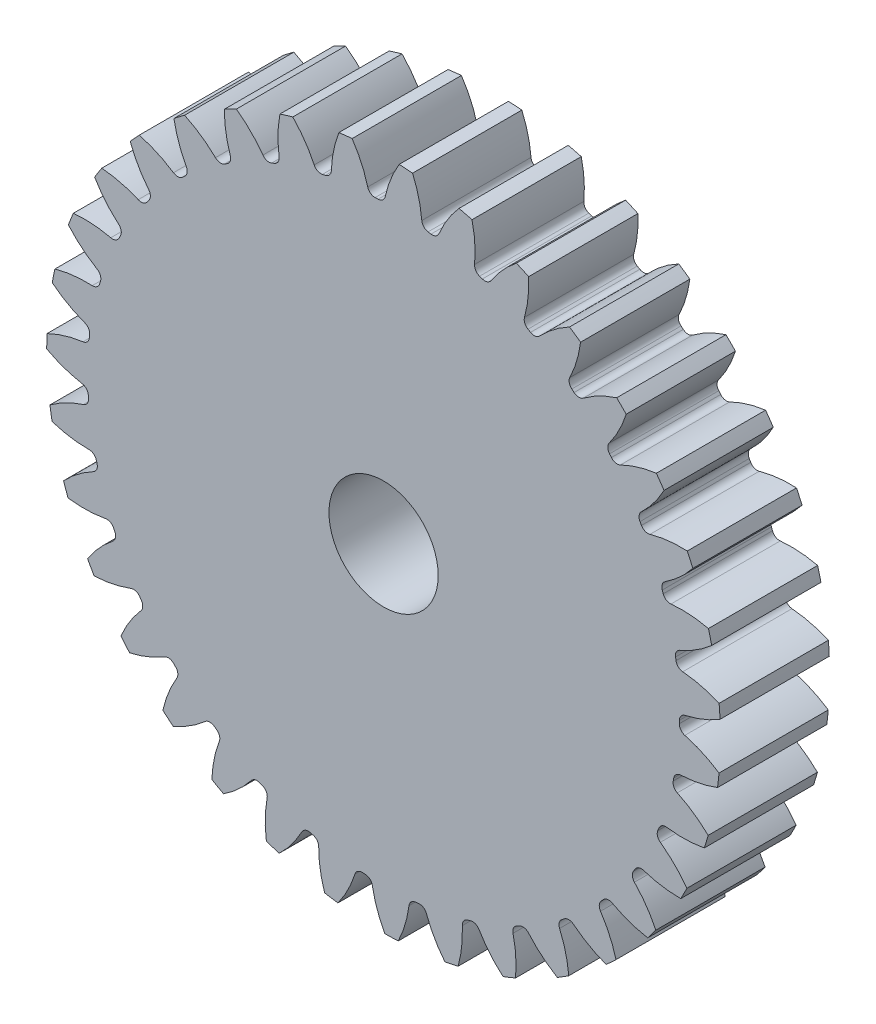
SolidWorks part; units mm, degrees
ref_plane "Front" through (0, 0, 0) normal (0, 0, 1) x (1, 0, 0)
ref_plane "Top" through (0, 0, 0) normal (0, 1, 0) x (1, 0, 0)
ref_plane "Right" through (0, 0, 0) normal (1, 0, 0) x (0, 0, -1)
sketch "Sketch3" plane through (0, 0, 0) normal (0, 0, 1) x (1, 0, 0)
  circle A0 centre (0, 0) radius 313.2667
  dimension "od" = 626.5333
extrude "gearBody" add sketch "Sketch3" along normal blind 101.6
sketch "Sketch2" plane through (0, 0, 0) normal (0, 0, 1) x (1, 0, 0)
  line L0 (0, 0) -> (257.2656, 106.5629) construction
  line L1 (312.3259, -28.7404) -> (0, 0) construction
  line L2 (0, 0) -> (36.3143, 0) construction
  line L3 (296.2521, 6.9378) -> (295.6876, -19.5518) construction
  line L5 (295.9699, -6.307) -> (0, 0) construction
  line L7 (0, 0) -> (278.4622, 0) construction
  arc A0 (278.4571, 1.7009) -> (278.1318, -13.5616) centre (0, 0) ccw construction
  arc A1 (312.8985, 15.184) -> (311.9676, -28.4997) centre (0, 0) ccw construction
  arc A2 (296.2521, 6.9378) -> (295.6876, -19.5518) centre (0, 0) ccw construction
  arc A3 (275.0712, -7.2493) -> (275.1303, -4.4753) centre (0, 0) ccw
  arc A4 (312.3259, -28.7404) -> (280.1772, -14.088) centre (252.4924, -117.4257) ccw
  arc A5 (312.3259, -28.7404) -> (313.2667, 15.4092) centre (0, 0) ccw
  arc A6 (313.2667, 15.4092) -> (280.523, 2.1397) centre (257.2656, 106.5629) cw
  arc A7 (275.1303, -4.4753) -> (280.523, 2.1397) centre (282.0212, -4.5874) cw
  arc A8 (280.1772, -14.088) -> (275.0712, -7.2493) centre (281.9606, -7.4309) cw
  point P6 (313.2667, 15.4092)
  point P22 (312.3259, -28.7404)
  dimension "baseDia" = 556.9245
  dimension "od" = 626.5333
  dimension "pd" = 592.6667
  dimension "rd" = 550.3333
  dimension "rFillet" = 6.8919
  dimension "pointX" = 313.2667
  dimension "pointY" = 15.4092
  dimension "CTT" = 26.4896
  dimension "flankCenterAngle" = 22.5
extrude "toothCut" cut sketch "Sketch2" along normal through all
pattern_circular "CirPattern1" count 35 over 360 about axis through (0, 0, 0) along (0, 0, 1) of "toothCut"
sketch "hub1Dia" plane through (0, 0, 0) normal (0, 0, -1) x (-1, 0, 0)
  circle A0 centre (0, 0) radius 12.7
  dimension "hub1Dia" = 25.4
sketch "hub2Dia" plane through (0, 0, 101.6) normal (0, 0, 1) x (1, 0, 0)
  circle A0 centre (0, 0) radius 12.7
  dimension "hub2dia" = 25.4
sketch "boreDia" plane through (0, 0, 0) normal (0, 0, 1) x (1, 0, 0)
  circle A0 centre (0, 0) radius 50.8
  dimension "boreDia" = 101.6
extrude "bore" cut sketch "boreDia" against normal mid plane 25400
